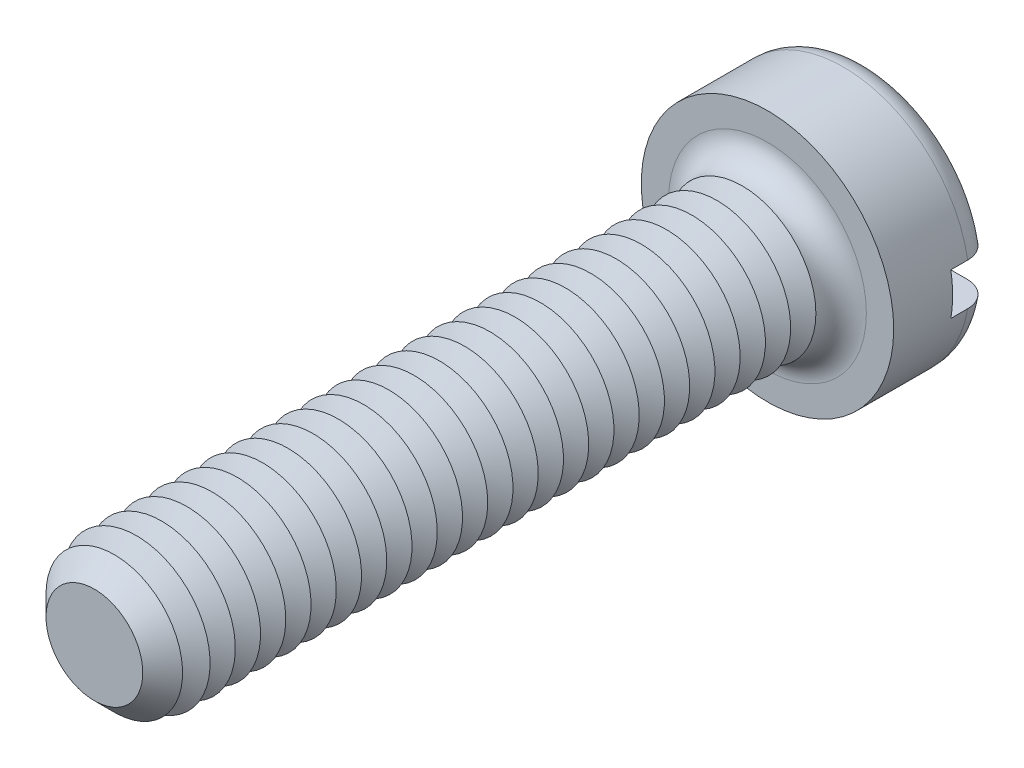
SolidWorks part; units mm, degrees
ref_plane "Front Plane" through (0, 0, 0) normal (0, 0, 1) x (1, 0, 0)
ref_plane "Top Plane" through (0, 0, 0) normal (0, 1, 0) x (1, 0, 0)
ref_plane "Right Plane" through (0, 0, 0) normal (1, 0, 0) x (0, 0, -1)
sketch "Sketch3" plane through (0, 0, 0) normal (0, 0, 1) x (1, 0, 0)
  circle A0 centre (0, 0) radius 3
  dimension "D1" = 6
extrude "Boss-Extrude2" add sketch "Sketch3" against normal blind 2.4
sketch "Sketch4" plane through (0, 0, 0) normal (0, 0, 1) x (1, 0, 0)
  circle A0 centre (0, 0) radius 1.75
  dimension "D1" = 3.5
extrude "Boss-Extrude3" add sketch "Sketch4" along normal blind 16
fillet "Fillet1" radius 0.6 2 edges at (3, 0, -2.4) (1.75, 0, 0)
chamfer "Chamfer1" distance 0.6 angle 45 1 edges at (1.75, 0, 16)
sketch "Sketch5" plane through (0, 0, 0) normal (1, 0, 0) x (0, 0, -1)
  line L0 (1.6944, 0) -> (-7.6738, 0) construction
sketch "Sketch6" plane through (0, 0, 0) normal (1, 0, 0) x (0, 0, -1)
  line L0 (-0.6, 1.75) -> (-0.9, 1.2304)
  line L1 (-0.9, 1.2304) -> (-1.2, 1.75)
  line L2 (-0.6, 1.75) -> (-15.4, 1.75) construction
  line L3 (-1.2, 1.75) -> (-0.6, 1.75)
  dimension "D1" = 0.6
revolve "Cut-Revolve1" cut sketch "Sketch6" angle 360 about L0
pattern_linear "LPattern1" count 25 spacing 0.6 along (0, 0, 1) of "Cut-Revolve1"
sketch "Sketch8" plane through (0, 0, -2.4) normal (0, 0, -1) x (-1, 0, 0)
  line L1 (3, -0.5) -> (-3, -0.5)
  line L2 (3, -0.5) -> (3, 0.5)
  line L3 (3, 0.5) -> (-3, 0.5)
  line L4 (-3, -0.5) -> (-3, 0.5)
  line L5 (3, -0.5) -> (-3, 0.5) construction
  line L6 (3, 0.5) -> (-3, -0.5) construction
  point P0 (0, 0)
  dimension "D1" = 6
  dimension "D2" = 1
extrude "Cut-Extrude1" cut sketch "Sketch8" against normal blind 1
